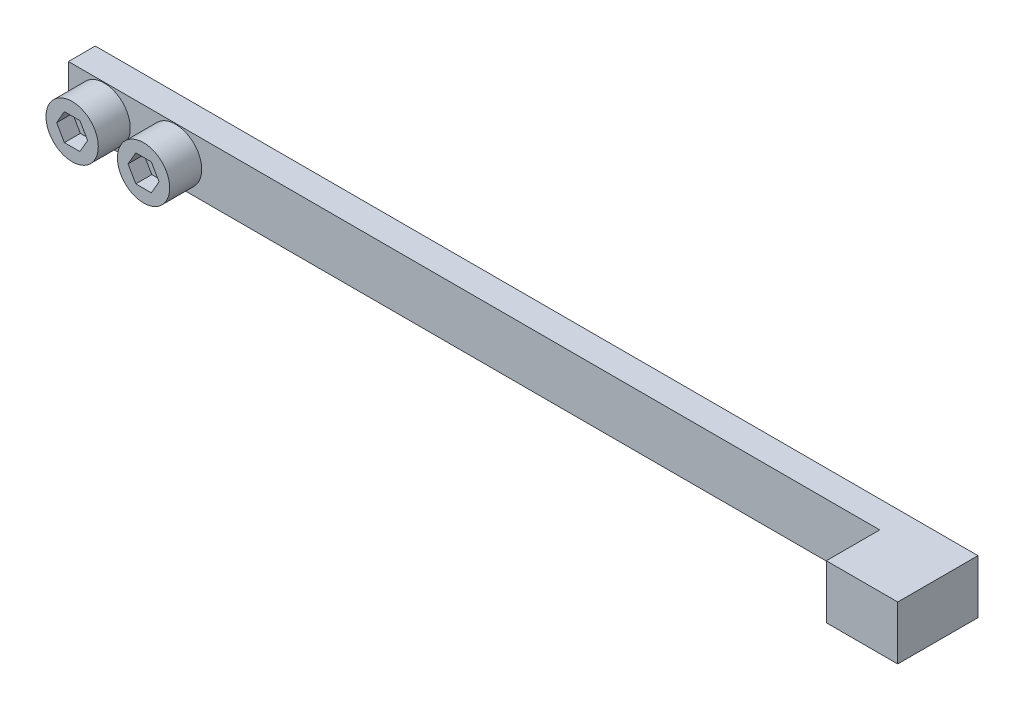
SolidWorks part; units mm, degrees
ref_plane "Front Plane" through (0, 0, 0) normal (0, 0, 1) x (1, 0, 0)
ref_plane "Top Plane" through (0, 0, 0) normal (0, 1, 0) x (1, 0, 0)
ref_plane "Right Plane" through (0, 0, 0) normal (1, 0, 0) x (0, 0, -1)
ref_plane "Plane1" through (-40.0812, 0, 0) normal (1, 0, 0) x (0, 0, -1)
ref_plane "Plane2" through (0, 0, -1.1938) normal (0, 0, 1) x (1, 0, 0)
ref_plane "Plane3" through (0, -2.3876, 0) normal (0, 1, 0) x (-1, 0, 0)
sketch "Sketch1" plane through (0, -2.3876, 0) normal (0, 1, 0) x (-1, 0, 0)
  line L0 (38.4048, -1.1938) -> (38.4048, 1.1938)
  line L1 (38.4048, 1.1938) -> (-33.7312, 1.1938)
  line L2 (-33.7312, 1.1938) -> (-33.7312, 5.9436)
  line L3 (-33.7312, 5.9436) -> (-40.0812, 5.9436)
  line L4 (-40.0812, 5.9436) -> (-40.0812, -1.1938)
  line L5 (-40.0812, -1.1938) -> (38.4048, -1.1938)
  dimension "D1" = 78.486
  dimension "D2" = 6.35
extrude "Extrude1" add sketch "Sketch1" along normal blind 4.7752
ref_plane "Plane4" through (0, 0, 1.1938) normal (0, 0, 1) x (1, 0, 0)
sketch "Sketch2" plane through (0, 0, 1.1938) normal (0, 0, 1) x (1, 0, 0)
  line L0 (-38.4048, 2.3876) -> (-38.4048, -2.3876) construction
  circle A0 centre (-35.2298, 0) radius 2.3241
  circle A1 centre (-28.8798, 0) radius 2.3241
  point P7 (-38.4048, 0)
  dimension "D3" = 4.6482
  dimension "D1" = 3.175
  dimension "D2" = 6.35
extrude "Extrude2" add sketch "Sketch2" along normal blind 2.8448
ref_plane "Plane5" through (0, 0, 4.0386) normal (0, 0, 1) x (1, 0, 0)
sketch "Sketch3" plane through (0, 0, 4.0386) normal (0, 0, 1) x (1, 0, 0)
  line L0 (-35.919, -1.1938) -> (-34.5406, -1.1938)
  line L1 (-34.5406, -1.1938) -> (-33.8513, 0)
  line L2 (-33.8513, 0) -> (-34.5406, 1.1938)
  line L3 (-34.5406, 1.1938) -> (-35.919, 1.1938)
  line L4 (-35.919, 1.1938) -> (-36.6083, 0)
  line L5 (-36.6083, 0) -> (-35.919, -1.1938)
  line L6 (-30.2583, 0) -> (-29.569, -1.1938)
  line L7 (-28.1906, 1.1938) -> (-29.569, 1.1938)
  line L8 (-27.5013, 0) -> (-28.1906, 1.1938)
  line L9 (-28.1906, -1.1938) -> (-27.5013, 0)
  line L10 (-29.569, 1.1938) -> (-30.2583, 0)
  line L11 (-29.569, -1.1938) -> (-28.1906, -1.1938)
  circle A0 centre (-35.2298, 0) radius 1.1938 construction
  circle A1 centre (-35.2298, 0) radius 2.3241 construction
  circle A2 centre (-28.8798, 0) radius 1.1938 construction
  circle A3 centre (-28.8798, 0) radius 2.3241 construction
  dimension "D1" = 2.3876
  dimension "D2" = 120
  dimension "D3" = 120
extrude "Cut-Extrude1" cut sketch "Sketch3" against normal blind 1.4224 contours L4 L5 L0 L1 L2 L3 | L6 L11 L9 L8 L7 L10
ref_plane "Plane6" through (-25.7048, 0, 0) normal (-1, 0, 0) x (0, 0, 1)
